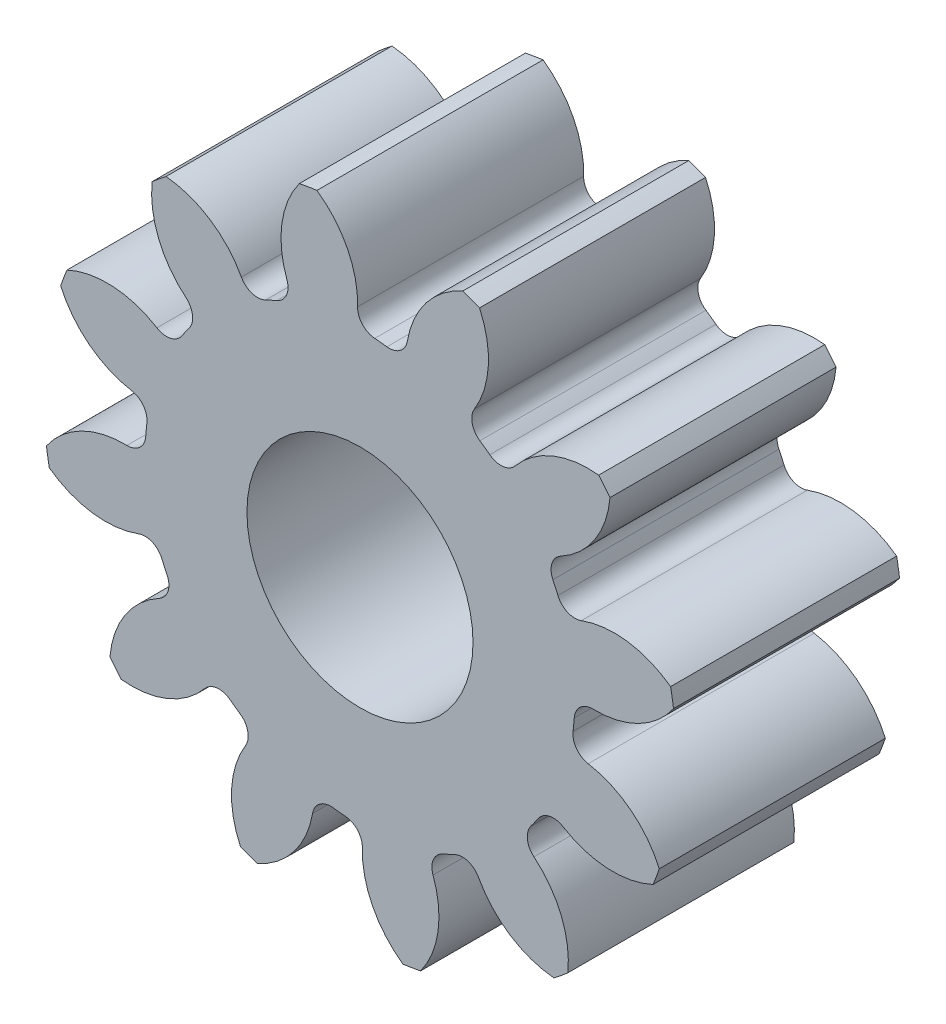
SolidWorks part; units mm, degrees
ref_plane "Front" through (0, 0, 0) normal (0, 0, 1) x (1, 0, 0)
ref_plane "Top" through (0, 0, 0) normal (0, 1, 0) x (1, 0, 0)
ref_plane "Right" through (0, 0, 0) normal (1, 0, 0) x (0, 0, -1)
sketch "Sketch3" plane through (0, 0, 0) normal (0, 0, 1) x (1, 0, 0)
  circle A0 centre (0, 0) radius 142.24
  dimension "od" = 284.48
extrude "gearBody" add sketch "Sketch3" along normal blind 101.6
sketch "Sketch2" plane through (0, 0, 0) normal (0, 0, 1) x (1, 0, 0)
  line L0 (0, 0) -> (105.8464, 43.843) construction
  line L1 (135.4314, -48.4292) -> (0, 0) construction
  line L2 (0, 0) -> (36.3143, 0) construction
  line L3 (121.8493, 4.152) -> (118.7466, -27.6355) construction
  line L5 (120.298, -11.7418) -> (0, 0) construction
  line L7 (0, 0) -> (114.5673, 0) construction
  arc A0 (114.5509, 1.9419) -> (112.0133, -24.0559) centre (0, 0) ccw construction
  arc A1 (140.9214, 19.3233) -> (134.5251, -46.2084) centre (0, 0) ccw construction
  arc A2 (121.8493, 4.152) -> (118.7466, -27.6355) centre (0, 0) ccw construction
  arc A3 (95.7576, -12.1076) -> (96.2915, -6.6375) centre (0, 0) ccw
  arc A4 (135.4314, -48.4292) -> (102.5711, -21.2973) centre (95.3708, -63.483) ccw
  arc A5 (135.4314, -48.4292) -> (142.24, 21.3269) centre (0, 0) ccw
  arc A6 (142.24, 21.3269) -> (104.7534, 1.0613) centre (105.8464, 43.843) cw
  arc A7 (96.2915, -6.6375) -> (104.7534, 1.0613) centre (104.5422, -7.2063) cw
  arc A8 (102.5711, -21.2973) -> (95.7576, -12.1076) centre (103.9625, -13.145) cw
  point P6 (142.24, 21.3269)
  point P22 (135.4314, -48.4292)
  dimension "baseDia" = 229.1346
  dimension "od" = 284.48
  dimension "pd" = 243.84
  dimension "rd" = 193.04
  dimension "rFillet" = 8.2702
  dimension "pointX" = 142.24
  dimension "pointY" = 21.3269
  dimension "CTT" = 31.7875
  dimension "flankCenterAngle" = 22.5
extrude "toothCut" cut sketch "Sketch2" along normal through all
pattern_circular "CirPattern1" count 12 over 360 about axis through (0, 0, 0) along (0, 0, 1) of "toothCut"
sketch "hub1Dia" plane through (0, 0, 0) normal (0, 0, -1) x (-1, 0, 0)
  circle A0 centre (0, 0) radius 12.7
  dimension "hub1Dia" = 25.4
sketch "hub2Dia" plane through (0, 0, 101.6) normal (0, 0, 1) x (1, 0, 0)
  circle A0 centre (0, 0) radius 12.7
  dimension "hub2dia" = 25.4
sketch "boreDia" plane through (0, 0, 0) normal (0, 0, 1) x (1, 0, 0)
  circle A0 centre (0, 0) radius 50.8
  dimension "boreDia" = 101.6
extrude "bore" cut sketch "boreDia" against normal mid plane 25400
